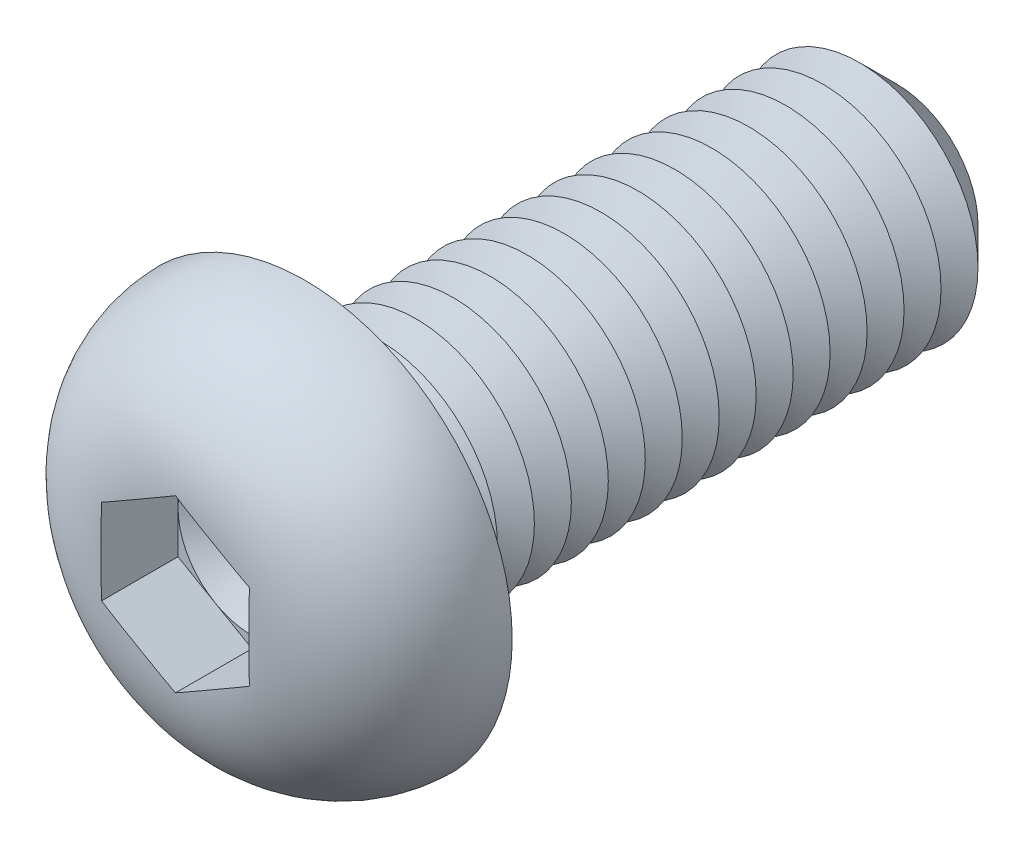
SolidWorks part; units mm, degrees
ref_plane "Front Plane" through (0, 0, 0) normal (0, 0, 1) x (1, 0, 0)
ref_plane "Top Plane" through (0, 0, 0) normal (0, 1, 0) x (1, 0, 0)
ref_plane "Right Plane" through (0, 0, 0) normal (1, 0, 0) x (0, 0, -1)
sketch "Sketch1" plane through (0, 0, 0) normal (1, 0, 0) x (0, 0, -1)
  line L0 (-47.9342, 0) -> (60.3146, 0) construction
sketch "Sketch2" plane through (0, 0, 0) normal (1, 0, 0) x (0, 0, -1)
  line L0 (0, 0) -> (-4.4, 0)
  line L1 (-47.9342, 0) -> (60.3146, 0) construction
  line L2 (-4.4, 0) -> (-4.4, 2.5011)
  line L3 (0, 7) -> (0, 0)
  arc A0 (-4.4, 2.5011) -> (0, 7) centre (0.1, 2.5011) cw
  dimension "D1" = 4.5
  dimension "D2" = 4.4
  dimension "D3" = 7
revolve "Revolve1" add sketch "Sketch2" angle 360 about L0
sketch "Sketch3" plane through (0, 0, 4.4) normal (0, 0, 1) x (1, 0, 0)
  line L1 (0, 2.8868) -> (-2.5, 1.4434)
  line L2 (-2.5, 1.4434) -> (-2.5, -1.4434)
  line L3 (-2.5, -1.4434) -> (0, -2.8868)
  line L4 (0, -2.8868) -> (2.5, -1.4434)
  line L5 (2.5, -1.4434) -> (2.5, 1.4434)
  line L6 (2.5, 1.4434) -> (0, 2.8868)
  circle A0 centre (0, 0) radius 2.5 construction
  dimension "D1" = 5
extrude "Cut-Extrude1" cut sketch "Sketch3" against normal blind 2.6
sketch "Sketch4" plane through (0, 0, 0) normal (0, 0, -1) x (-1, 0, 0)
  circle A0 centre (0, 0) radius 4
  dimension "D1" = 8
extrude "Boss-Extrude1" add sketch "Sketch4" along normal blind 20
chamfer "Chamfer1" distance 1.25 angle 45 1 edges at (-4, 0, -20)
sketch "Sketch5" plane through (0, 0, 0) normal (1, 0, 0) x (0, 0, -1)
  line L0 (1.25, 4) -> (2.5, 4)
  line L1 (18.75, 4) -> (0, 4) construction
  line L2 (2.5, 4) -> (1.875, 2.9175)
  line L3 (1.875, 2.9175) -> (1.25, 4)
  line L4 (0, -7) -> (0, 7) construction
  line L5 (18.75, 4) -> (0, 4) construction
  dimension "D1" = 1.25
  dimension "D2" = 1.25
revolve "Cut-Revolve1" cut sketch "Sketch5" angle 360 about L0
pattern_linear "LPattern1" count 14 spacing 1.25 along (0, 0, -1) of "Cut-Revolve1"
fillet "Fillet2" radius 0.5 1 edges at (4, 0, 0)
sketch "Sketch6" plane through (0, 0, 1.8) normal (0, 0, 1) x (1, 0, 0)
  line L0 (0, -2.8868) -> (2.5, -1.4434) construction
  circle A0 centre (0, 0) radius 2.5
extrude "Cut-Extrude2" cut sketch "Sketch6" against normal through all draft 60
